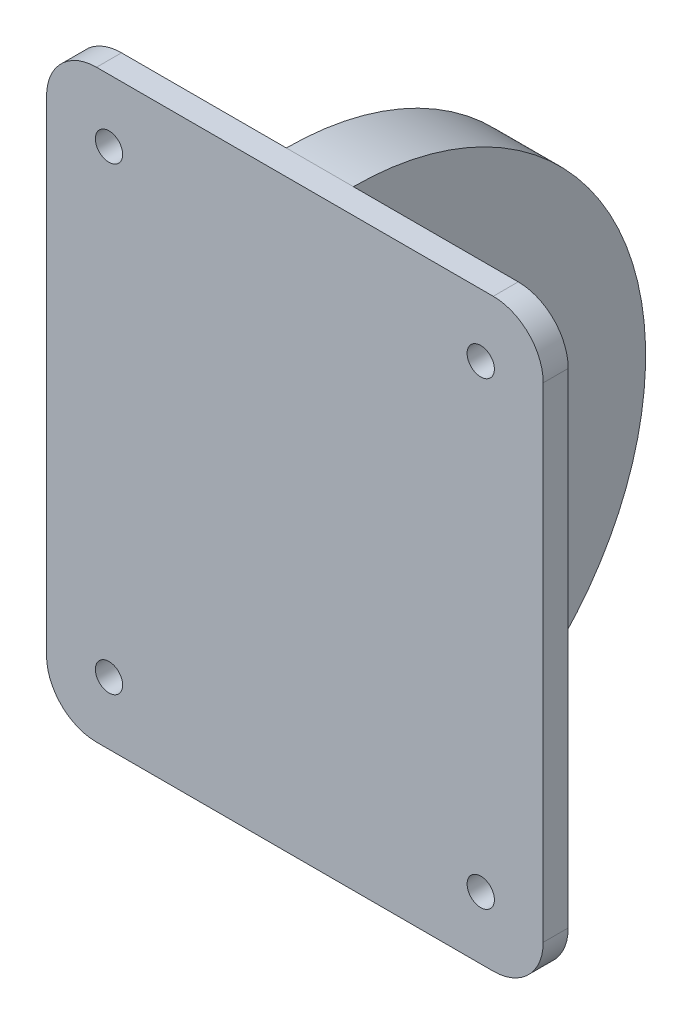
SolidWorks part; units mm, degrees
ref_plane "Front Plane" through (0, 0, 0) normal (0, 0, 1) x (1, 0, 0)
ref_plane "Top Plane" through (0, 0, 0) normal (0, 1, 0) x (1, 0, 0)
ref_plane "Right Plane" through (0, 0, 0) normal (1, 0, 0) x (0, 0, -1)
sketch "Sketch1" plane through (0, 0, 0) normal (0, 0, 1) x (1, 0, 0)
  line L1 (-19.8759, 23.3897) -> (19.8759, 23.3897)
  line L2 (-19.8759, 23.3897) -> (-19.8759, -23.3897)
  line L3 (-19.8759, -23.3897) -> (19.8759, -23.3897)
  line L4 (19.8759, 23.3897) -> (19.8759, -23.3897)
  line L5 (-19.8759, 23.3897) -> (19.8759, -23.3897) construction
  line L6 (-19.8759, -23.3897) -> (19.8759, 23.3897) construction
  point P0 (0, 0)
extrude "Boss-Extrude1" add sketch "Sketch1" along normal blind 2
fillet "Fillet1" radius 4 4 edges at (-19.8759, -23.3897, 1) (19.8759, -23.3897, 1) (-19.8759, 23.3897, 1) (19.8759, 23.3897, 1)
sketch "Sketch2" plane through (0, 0, 2) normal (0, 0, 1) x (1, 0, 0)
  line L0 (15.8759, 23.3897) -> (-15.8759, 23.3897) construction
  line L1 (-19.8759, 19.3897) -> (-19.8759, -19.3897) construction
  line L2 (19.8759, -19.3897) -> (19.8759, 19.3897) construction
  line L3 (-15.8759, -23.3897) -> (15.8759, -23.3897) construction
  circle A0 centre (-14.8759, 18.3897) radius 1.0922
  circle A1 centre (14.8759, 18.3897) radius 1.0922
  circle A2 centre (-14.8759, -18.3897) radius 1.0922
  circle A3 centre (14.8759, -18.3897) radius 1.0922
  dimension "D1" = 2.1844
  dimension "D2" = 2.1844
  dimension "D3" = 2.1844
  dimension "D4" = 2.1844
  dimension "D5" = 5
  dimension "D6" = 5
  dimension "D7" = 5
  dimension "D8" = 5
  dimension "D9" = 5
  dimension "D10" = 5
  dimension "D11" = 5
  dimension "D12" = 5
extrude "Cut-Extrude1" cut sketch "Sketch2" against normal blind 2
sketch "Sketch5" plane through (0, 0, 0) normal (1, 0, 0) x (0, 0, -1)
  line L0 (0, 23.3897) -> (0, -23.3897) construction
  line L1 (0, 23.3897) -> (0, -23.3897)
  arc A0 (0, -23.3897) -> (0, 23.3897) centre (0, 0) ccw
extrude "Boss-Extrude2" add sketch "Sketch5" along normal mid plane 5.3667
sketch "Sketch6" plane through (2.6833, 0, 0) normal (1, 0, 0) x (0, 0, -1)
  line L0 (0, -19.3897) -> (0, 19.3897) construction
  line L1 (0, -23.3897) -> (-2, -23.3897) construction
  circle A0 centre (10.61, 0) radius 5
extrude "Cut-Extrude2" cut sketch "Sketch6" against normal up to next
equation "\"userHeight\"= 1610mm'Users height"
equation "\"fin_hole_radius\"= 10mm'Fin hole radius"
equation "\"fin_thickness\"= 5 * \"userHeight\" / 1500'Fin thickness"
equation "\"D1\"= \"fin_thickness\""
equation "\"D2@Sketch6\"=\"fin_hole_radius\""
equation "\"D1@Boss-Extrude2\"=\"fin_thickness\""
equation "\"fin_platform_width\"= 2 * \"userHeight\" / 20 * sin ( 18deg ) - 10'Platform width of fin part"
equation "\"D2@Sketch1\"=\"fin_platform_width\""
equation "\"fin_platform_height\"= ( 70.58 - 60 ) / ( 2000 - 1700 ) * \"userHeight\" - 10'Platform height fin part"
equation "\"D1@Sketch1\"=\"fin_platform_height\""
equation "\"hole_position_y\"= 25 * \"fin_platform_height\" / 50'Fin platform position y"
equation "\"D3@Sketch6\"=\"hole_position_y\""
equation "\"D1@Sketch5\"=\"fin_platform_height\""
